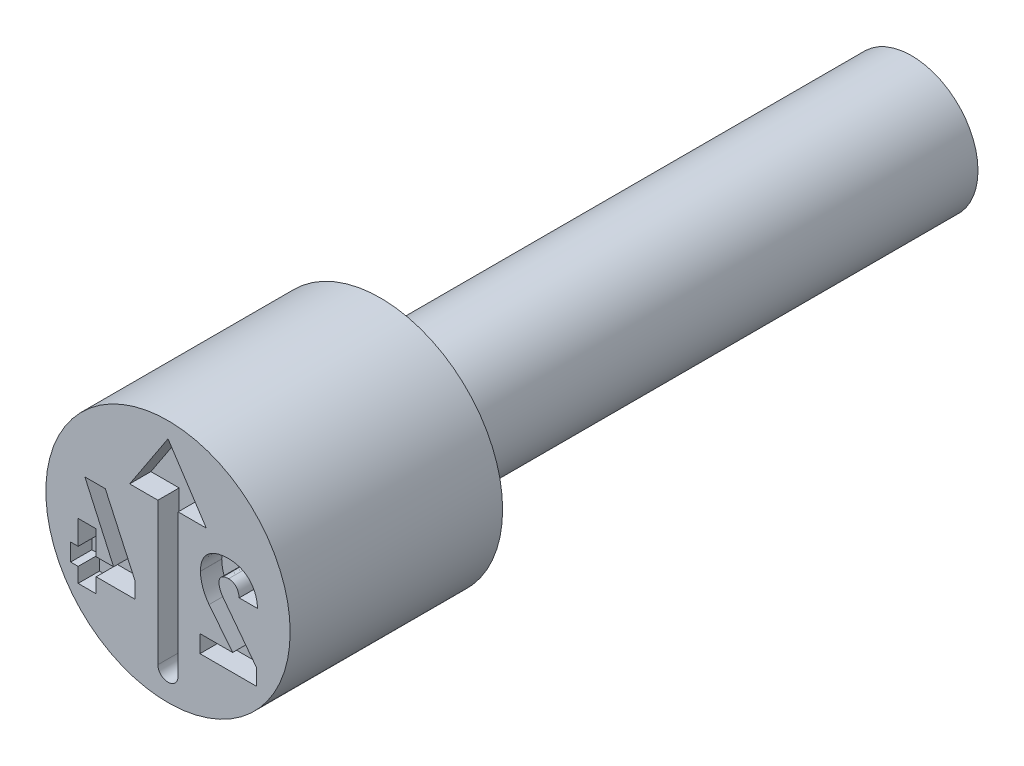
SolidWorks part; units mm, degrees
ref_plane "Front Plane" through (0, 0, 0) normal (0, 0, 1) x (1, 0, 0)
ref_plane "Top Plane" through (0, 0, 0) normal (0, 1, 0) x (1, 0, 0)
ref_plane "Right Plane" through (0, 0, 0) normal (1, 0, 0) x (0, 0, -1)
sketch "Sketch2" plane through (0, 0, 0) normal (1, 0, 0) x (0, 0, -1)
  line L0 (0.4039, 0) -> (50000.4039, 0) construction
  line L6 (0, 2.3) -> (0, 0)
  line L7 (4, 2.3) -> (0, 2.3)
  line L8 (4, 1.25) -> (4, 2.3)
  line L9 (14, 1.25) -> (4, 1.25)
  line L10 (14, 0) -> (14, 1.25)
  line L11 (0, 0) -> (14, 0)
  dimension "D1" = 4.6
  dimension "D2" = 2.5
  dimension "D3" = 14
  dimension "D4" = 4
revolve "Revolve1" add sketch "Sketch2" angle 360 about L0
sketch "Sketch3" plane through (0, 0, 0) normal (0, 0, 1) x (1, 0, 0)
  line L0 (0, 0) -> (0, 100000) construction
  line L1 (0.1905, 0.9064) -> (0.1905, -1.7762)
  line L2 (0.7219, 0.9064) -> (0.1905, 0.9064)
  line L3 (0, 2.0021) -> (0.7219, 0.9064)
  line L15 (0, 2.0021) -> (-0.7219, 0.9064)
  line L16 (-0.7219, 0.9064) -> (-0.1905, 0.9064)
  line L17 (-0.1905, 0.9064) -> (-0.1905, -1.7762)
  arc A2 (-0.1905, -1.7762) -> (0.1905, -1.7762) centre (0, -1.7762) ccw
extrude "Cut-Extrude4" cut sketch "Sketch3" against normal blind 0.4
sketch "Sketch4" plane through (0, 0, 0) normal (0, 0, 1) x (1, 0, 0)
  text T0 "2  4" font "Bahnschrift" height 1.8
  dimension "D1" = 1.2
  dimension "D2" = 1.8
extrude "Cut-Extrude5" cut sketch "Sketch4" against normal blind 0.4
